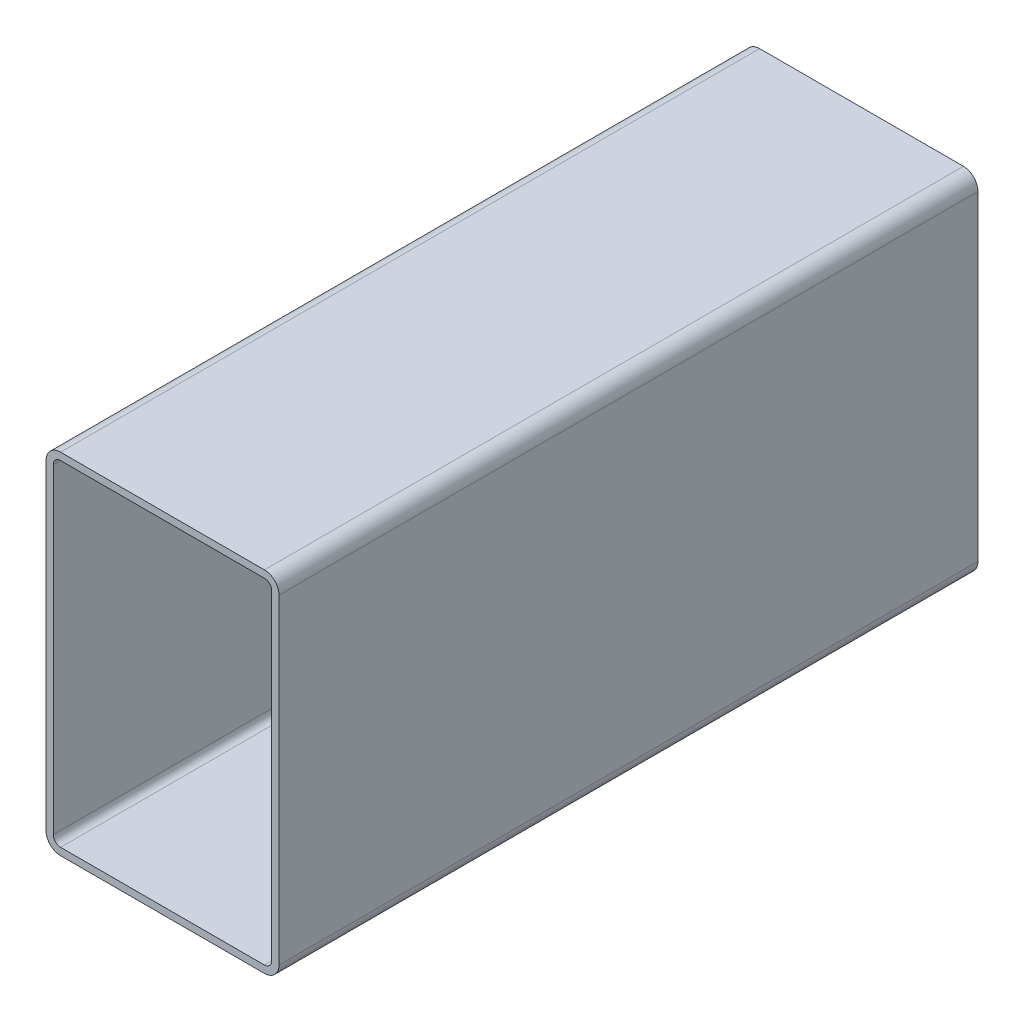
SolidWorks part; units mm, degrees
ref_plane "Front Plane" through (0, 0, 0) normal (0, 0, 1) x (1, 0, 0)
ref_plane "Top Plane" through (0, 0, 0) normal (0, 1, 0) x (1, 0, 0)
ref_plane "Right Plane" through (0, 0, 0) normal (1, 0, 0) x (0, 0, -1)
sketch "Sketch1" plane through (0, 0, 0) normal (0, 0, 1) x (1, 0, 0)
sketch_block_instance "HSS6x4x0.125-1"
sketch_block "HSS6x4x0.125"
extrude "Boss-Extrude1" add sketch "Sketch1" along normal blind 304.8
